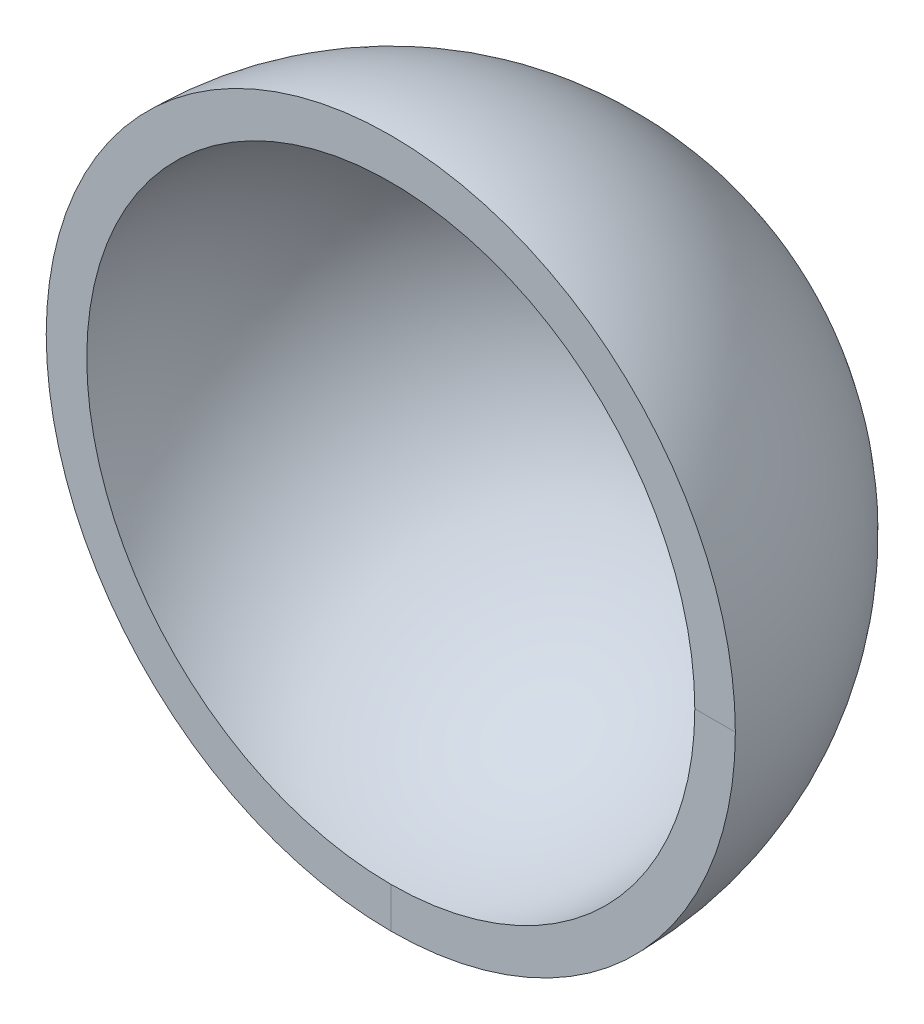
SolidWorks part; units mm, degrees
ref_plane "Front Plane" through (0, 0, 0) normal (0, 0, 1) x (1, 0, 0)
ref_plane "Top Plane" through (0, 0, 0) normal (0, 1, 0) x (1, 0, 0)
ref_plane "Right Plane" through (0, 0, 0) normal (1, 0, 0) x (0, 0, -1)
sketch "Sketch1" plane through (0, 0, 0) normal (0, 0, 1) x (1, 0, 0)
  line L0 (0, 0) -> (0, 43.18) construction
  line L1 (0, 43.18) -> (0, 40.64)
  line L2 (0, 2.54) -> (0, 0)
  arc A0 (0, 2.54) -> (0, 40.64) centre (0, 21.59) ccw
  arc A1 (0, 0) -> (0, 43.18) centre (0, 21.59) ccw
  dimension "D1" = 38.1
  dimension "D2" = 2.54
revolve "Revolve1" add sketch "Sketch1" angle 180 about L0
sketch "Sketch2" plane through (0, 0, 0) normal (0, 0, 1) x (1, 0, 0)
  line L1 (0, 21.59) -> (27.832, 21.59)
  line L2 (0, 21.59) -> (0, -33.4394)
  line L3 (0, -33.4394) -> (27.832, -33.4394)
  line L4 (27.832, 21.59) -> (27.832, -33.4394)
  circle A0 centre (0, 21.59) radius 21.59 construction
sketch "Sketch4" plane through (0, 0, 0) normal (0, 0, 1) x (1, 0, 0)
  arc A0 (21.59, 21.59) -> (0, 0) centre (0, 21.59) ccw construction
  point P0 (0, 21.59)
ref_plane "Plane1" through (0, 21.59, 0) normal (0, 1, 0) x (-1, 0, 0)
